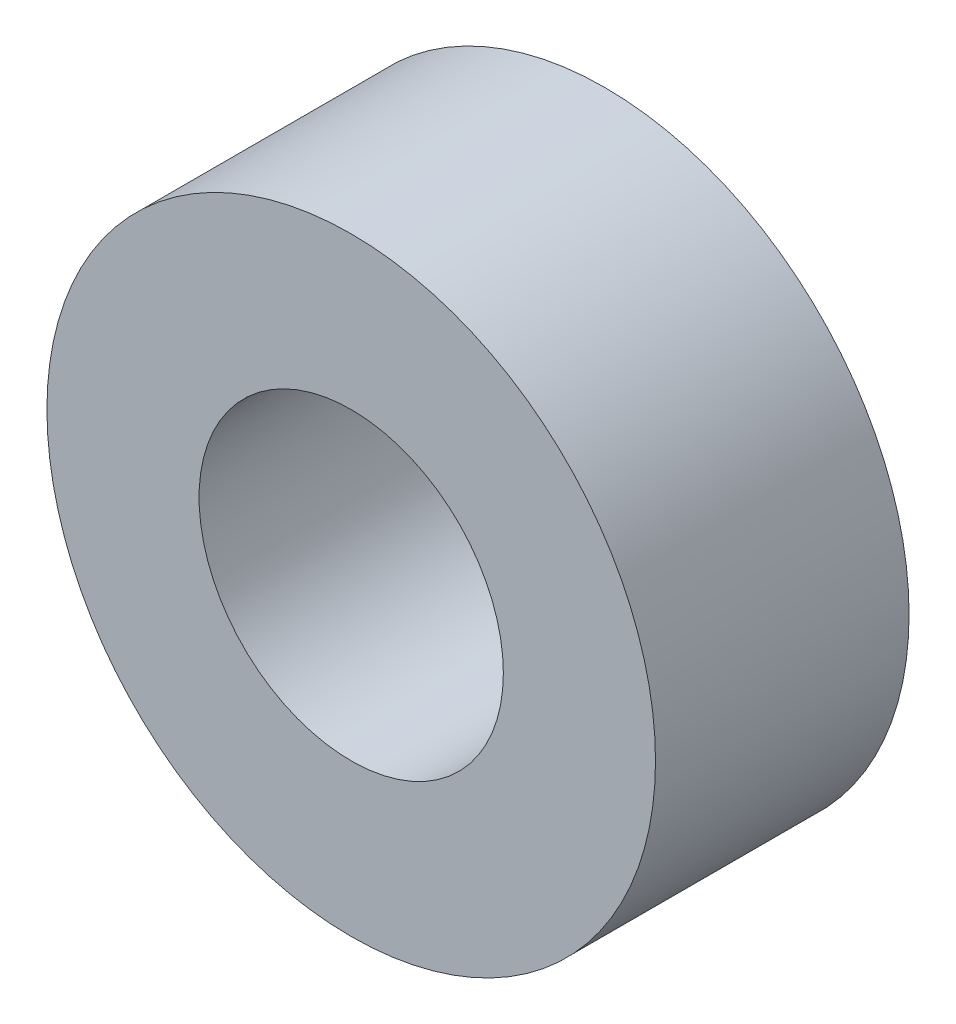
SolidWorks part; units mm, degrees
ref_plane "Front Plane" through (0, 0, 0) normal (0, 0, 1) x (1, 0, 0)
ref_plane "Top Plane" through (0, 0, 0) normal (0, 1, 0) x (1, 0, 0)
ref_plane "Right Plane" through (0, 0, 0) normal (1, 0, 0) x (0, 0, -1)
sketch "Sketch1" plane through (0, 0, 0) normal (0, 0, 1) x (1, 0, 0)
  circle A0 centre (0, 0) radius 7.62
  circle A1 centre (0, 0) radius 3.81
  dimension "D1" = 15.24
  dimension "D2" = 7.62
extrude "Boss-Extrude1" add sketch "Sketch1" along normal blind 6.35
